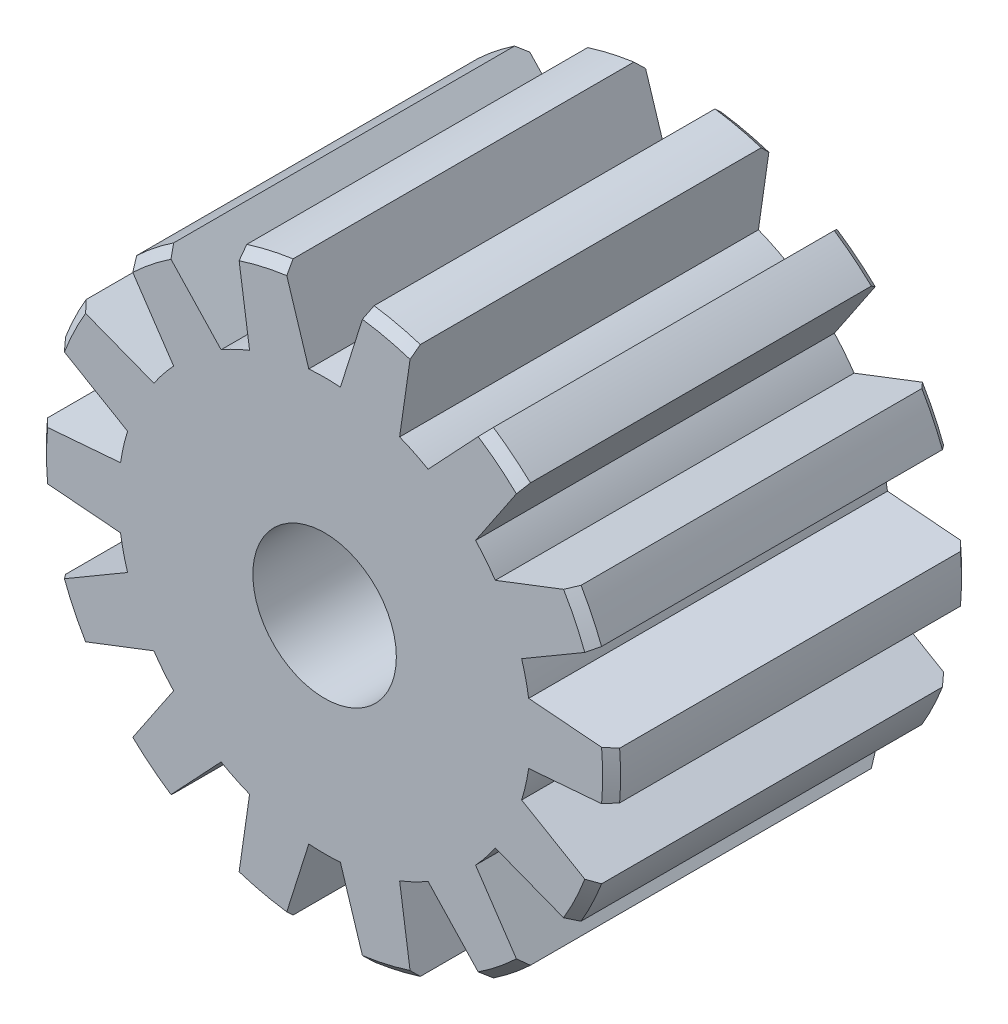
SolidWorks part; units mm, degrees
ref_plane "Plan1" through (0, 0, 0) normal (0, 0, 1) x (1, 0, 0)
ref_plane "Plan2" through (0, 0, 0) normal (0, 1, 0) x (1, 0, 0)
ref_plane "Plan3" through (0, 0, 0) normal (1, 0, 0) x (0, 0, -1)
sketch "Diamètre primitif" plane through (0, 0, 0) normal (0, 0, 1) x (1, 0, 0)
  line L0 (0, 0) -> (0.5, 0) construction
  circle A0 centre (0, 0) radius 3.5
  point P3 (0, 0)
  dimension "D1" = 7
  dimension "D2" = 0.5
sketch "Esquisse2" plane through (0, 0, 0) normal (0, 0, 1) x (1, 0, 0)
  circle A0 centre (0, 0) radius 4
  dimension "D1" = 8
extrude "Diamètre de tête" add sketch "Esquisse2" along normal mid plane 5
chamfer "Chanfreins" distance 0.125 angle 45
sketch "Esquisse3" plane through (0, 0, 0) normal (0, 0, 1) x (1, 0, 0)
  line L0 (0, 0) -> (0, 4) construction
  line L1 (-0.2203, 2.8665) -> (-0.5651, 3.9599)
  line L2 (0.2203, 2.8665) -> (0.5651, 3.9599)
  arc A0 (0.2203, 2.8665) -> (-0.2203, 2.8665) centre (0, 0) ccw
  circle A1 centre (0, 0) radius 4 construction
  arc A2 (0.5651, 3.9599) -> (-0.5651, 3.9599) centre (0, 0) ccw
  point P1 (-0.3927, 3.4132)
  point P10 (0.3927, 3.4132)
  dimension "D1" = 5.75
  dimension "D2" = 0.7854
  dimension "D3" = 325
extrude "Creux dent" cut sketch "Esquisse3" against normal through all and the other way through all
pattern_circular "Répétition" count 14 over 360
sketch "Esquisse4" plane through (0, 0, 2.5) normal (0, 0, 1) x (1, 0, 0)
  circle A0 centre (0, 0) radius 1
  dimension "D1" = 2
extrude "Enlèv. mat.-Extru.1" cut sketch "Esquisse4" against normal through all
equation "\"D1@Esquisse2\" = \"D1@Diamètre primitif\" + 2 * \"D2@Diamètre primitif\""
equation "\"D1@Chanfreins\" = 0.25*\"D2@Diamètre primitif\""
equation "\"D1@Esquisse3\" = \"D1@Diamètre primitif\"-2.5*\"D2@Diamètre primitif\""
equation "\"D2@Esquisse3\"=3.14159*\"D2@Diamètre primitif\"/2"
equation "\"D1@Répétition\" = \"D1@Diamètre primitif\"/\"D2@Diamètre primitif\""
